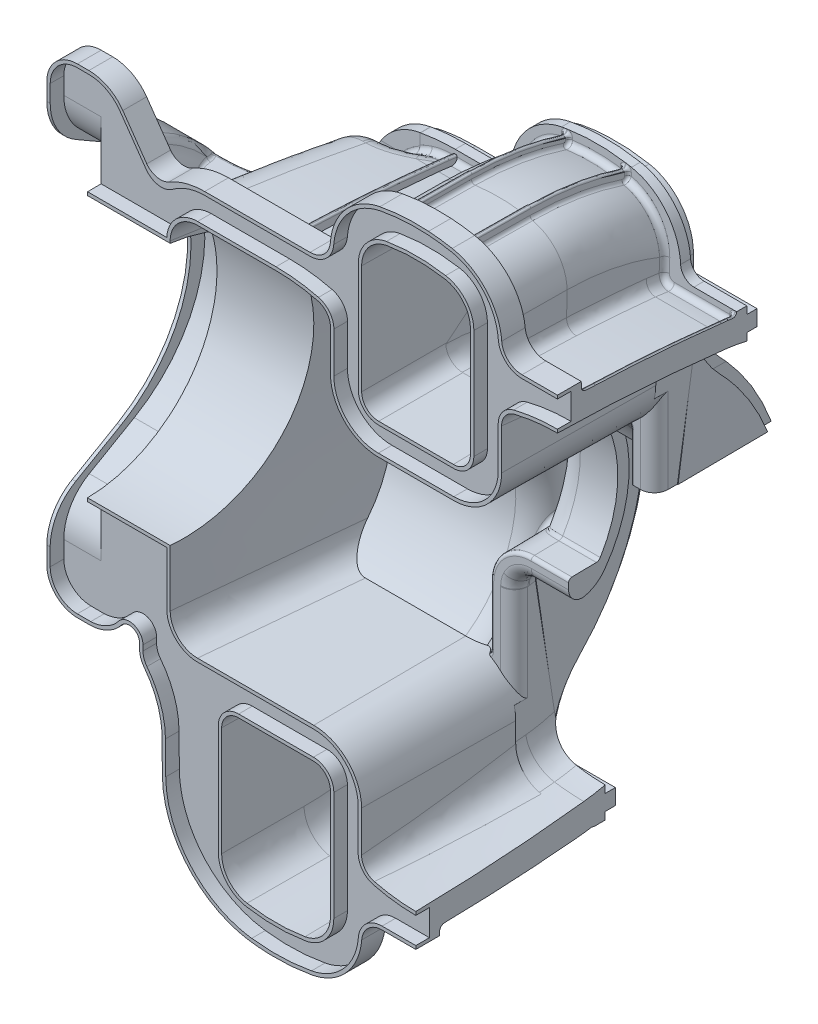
SolidWorks part; units mm, degrees
ref_plane "Front Plane" through (0, 0, 0) normal (0, 0, 1) x (1, 0, 0)
ref_plane "Top Plane" through (0, 0, 0) normal (0, 1, 0) x (1, 0, 0)
ref_plane "Right Plane" through (0, 0, 0) normal (1, 0, 0) x (0, 0, -1)
imported_body "Imported2"
other "DeleteFace1"
